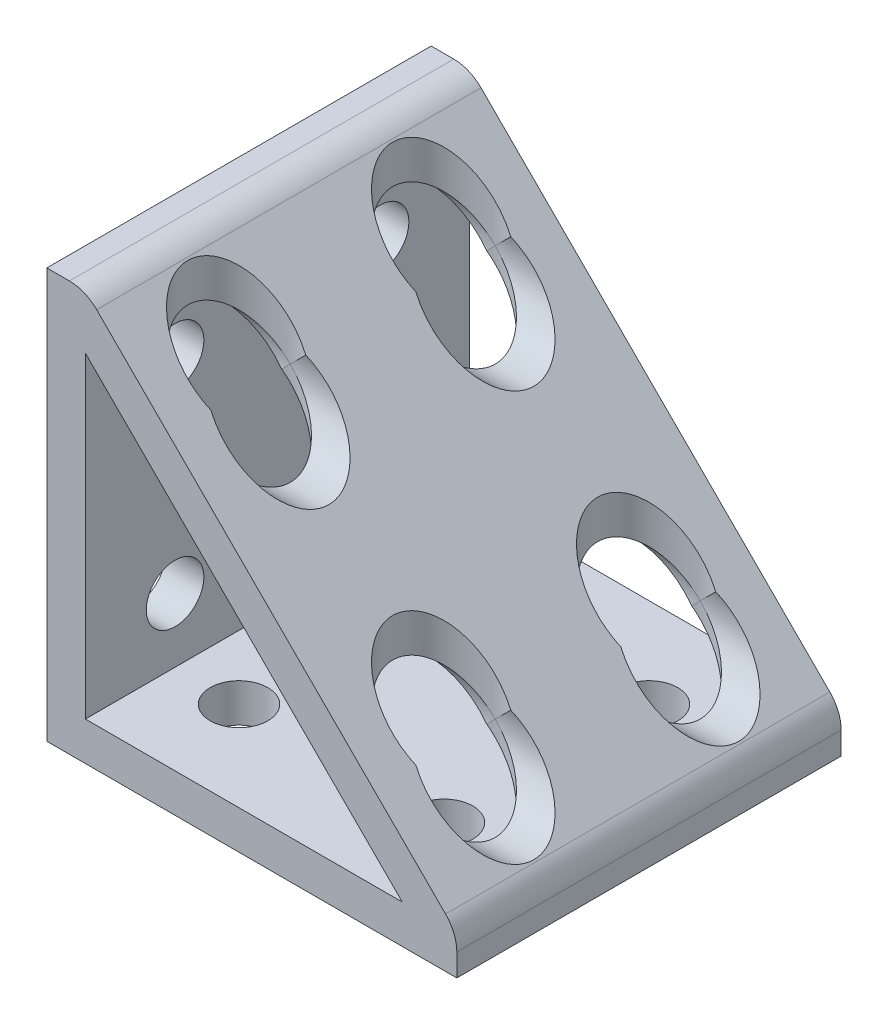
SolidWorks part; units mm, degrees
ref_plane "Front Plane" through (0, 0, 0) normal (0, 0, 1) x (1, 0, 0)
ref_plane "Top Plane" through (0, 0, 0) normal (0, 1, 0) x (1, 0, 0)
ref_plane "Right Plane" through (0, 0, 0) normal (1, 0, 0) x (0, 0, -1)
sketch "Sketch1" plane through (0, 0, 0) normal (0, 0, 1) x (1, 0, 0)
  line L0 (-25.4, -25.4) -> (-25.4, 25.4) construction
  line L1 (25.4, -25.4) -> (-25.4, -25.4) construction
  line L2 (25.4, -25.4) -> (25.4, -20.6248) construction
  point P3 (-25.4, 0)
  point P6 (0, -25.4)
sketch "Sketch2" plane through (0, 0, 0) normal (1, 0, 0) x (0, 0, -1)
  line L0 (23.8125, -25.4) -> (-23.8125, -25.4) construction
  line L1 (-12.7, -9.1313) -> (-12.7, -16.2687) construction
  line L2 (-6.35, -12.7) -> (-19.05, -12.7) construction
  line L3 (0, -25.4) -> (0, 25.4) construction
  line L4 (0, -25.4) -> (0, 25.4) construction
  point P4 (0, -25.4)
  point P8 (-12.7, -12.7)
  point P11 (-12.7, -12.7)
  dimension "Width" = 47.625
  dimension "Hole to Bottom" = 12.7
  dimension "Hole Spacing" = 25.4
  dimension "Thru Hole Dia" = 7.1374
  dimension "C'Bore Dia" = 12.7
sketch "Sketch3" plane through (0, 0, 0) normal (0, 0, 1) x (1, 0, 0)
  line L0 (-25.4, 25.4) -> (-25.4, -25.4)
  line L1 (-25.4, -25.4) -> (25.4, -25.4)
  line L2 (25.4, -25.4) -> (25.4, -22.6028)
  line L3 (25.4, -25.4) -> (25.4, -20.6248) construction
  line L4 (24.0014, -19.2262) -> (-19.2262, 24.0014)
  line L5 (-22.6028, 25.4) -> (-25.4, 25.4)
  line L6 (-20.6248, 18.6468) -> (-20.6248, -20.6248)
  line L7 (-20.6248, -20.6248) -> (18.6468, -20.6248)
  line L8 (18.6468, -20.6248) -> (-20.6248, 18.6468)
  line L9 (-20.6248, 18.6468) -> (-25.4, 18.6468) construction
  line L10 (-20.6248, 18.6468) -> (-17.2482, 22.0234) construction
  arc A0 (25.4, -22.6028) -> (24.0014, -19.2262) centre (20.6248, -22.6028) ccw
  arc A1 (-19.2262, 24.0014) -> (-22.6028, 25.4) centre (-22.6028, 20.6248) ccw
  point P15 (25.4, -20.6248)
extrude "Boss-Extrude1" add sketch "Sketch3" against normal up to vertex and the other way up to vertex
sketch "Sketch4" plane through (-25.4, 0, 0) normal (-1, 0, 0) x (0, 0, 1)
  line L0 (12.7, -9.1313) -> (12.7, -16.2687) construction
  line L1 (0, -25.4) -> (0, 25.4) construction
  line L2 (0, -25.4) -> (0, 25.4) construction
  line L3 (12.7, -12.7) -> (-12.7, -12.7) construction
  line L4 (-12.7, -12.7) -> (-12.7, 12.7) construction
  circle A0 centre (12.7, -12.7) radius 3.5687
  circle A1 centre (-12.7, -12.7) radius 3.5687
  circle A2 centre (-12.7, 12.7) radius 3.5687
  circle A3 centre (12.7, 12.7) radius 3.5687
extrude "Cut-Extrude1" cut sketch "Sketch4" against normal through all
sketch "Sketch5" plane through (-20.6248, 0, 0) normal (1, 0, 0) x (0, 0, -1)
  line L0 (0, -25.4) -> (0, 25.4) construction
  line L1 (0, -25.4) -> (0, 25.4) construction
  circle A0 centre (-12.7, -12.7) radius 6.35
  circle A1 centre (12.7, -12.7) radius 6.35
  circle A2 centre (-12.7, 12.7) radius 6.35
  circle A3 centre (12.7, 12.7) radius 6.35
extrude "Cut-Extrude2" cut sketch "Sketch5" along normal through all
ref_plane "Plane1" through (0, 0, 0) normal (0.7071, -0.7071, 0) x (-0.7071, -0.7071, 0)
mirror "Mirror1" about plane through (0, 0, 0) normal (0.7071, -0.7071, 0) of "Cut-Extrude2", "Cut-Extrude1"
equation "\"D1@Sketch3\"=\"Thickness@Sketch1\""
equation "\"D2@Sketch3\"=\"Thickness@Sketch1\""
